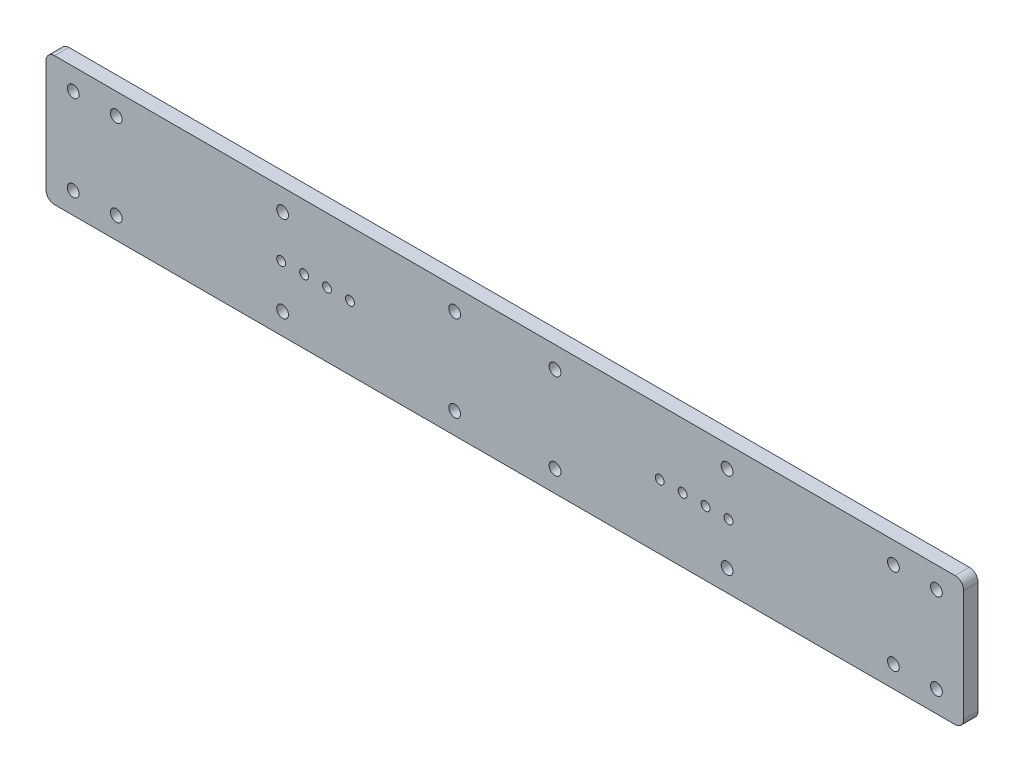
SolidWorks part; units mm, degrees
ref_plane "前视基准面" through (0, 0, 0) normal (0, 0, 1) x (1, 0, 0)
ref_plane "上视基准面" through (0, 0, 0) normal (0, 1, 0) x (1, 0, 0)
ref_plane "右视基准面" through (0, 0, 0) normal (1, 0, 0) x (0, 0, -1)
sketch "草图1" plane through (0, 0, 0) normal (0, 0, 1) x (1, 0, 0)
  line L0 (0, 0) -> (0, 22.5) construction
  line L1 (-160, -22.5) -> (160, -22.5)
  line L2 (-160, -22.5) -> (-160, 22.5)
  line L3 (-160, 22.5) -> (160, 22.5)
  line L4 (160, -22.5) -> (160, 22.5)
  line L5 (-160, -22.5) -> (160, 22.5) construction
  line L6 (-160, 22.5) -> (160, -22.5) construction
  line L7 (0, 0) -> (-160, 0) construction
  circle A0 centre (-17.5, 15) radius 2.05
  circle A1 centre (17.5, 15) radius 2.05
  circle A2 centre (17.5, -15) radius 2.05
  circle A3 centre (-17.5, -15) radius 2.05
  circle A4 centre (-150.5, 15) radius 2.05
  circle A5 centre (-135.5, 15) radius 2.05
  circle A6 centre (-135.5, -15) radius 2.05
  circle A7 centre (-150.5, -15) radius 2.05
  circle A8 centre (150.5, 15) radius 2.05
  circle A9 centre (150.5, -15) radius 2.05
  circle A10 centre (135.5, -15) radius 2.05
  circle A11 centre (135.5, 15) radius 2.05
  circle A12 centre (-77.5, 15) radius 2.05
  circle A13 centre (-77.5, -15) radius 2.05
  circle A14 centre (77.5, -15) radius 2.05
  circle A15 centre (77.5, 15) radius 2.05
  point P0 (0, 0)
  dimension "D3" = 4.1
  dimension "D4" = 35
  dimension "D5" = 30
  dimension "D6" = 2
  dimension "D8" = 30
  dimension "D9" = 9.5
  dimension "D10" = 2
  dimension "D12" = 4.1
  dimension "D1" = 320
  dimension "D2" = 45
  dimension "D7" = 2
  dimension "D11" = 2
  dimension "D13" = 2
extrude "凸台-拉伸1" add sketch "草图1" along normal blind 5
sketch "草图2" plane through (0, 0, 5) normal (0, 0, 1) x (1, 0, 0)
  line L0 (0, 0) -> (-165.3838, 0) construction
  line L1 (0, 0) -> (0, 53.0605) construction
  circle A0 centre (-70, 0) radius 1.55
  circle A1 centre (-78, 0) radius 1.55
  circle A2 centre (70, 0) radius 1.55
  circle A3 centre (78, 0) radius 1.55
  circle A4 centre (54, 0) radius 1.55
  circle A5 centre (62, 0) radius 1.55
  circle A6 centre (-54, 0) radius 1.55
  circle A7 centre (-62, 0) radius 1.55
  dimension "D1" = 3.1
  dimension "D2" = 3.1
  dimension "D3" = 70
  dimension "D4" = 8
  dimension "D5" = 2
extrude "切除-拉伸2" cut sketch "草图2" against normal blind 10
sketch "草图3" plane through (0, 0, 5) normal (0, 0, 1) x (1, 0, 0)
  line L0 (160, 22.5) -> (-160, 22.5) construction
  line L1 (-87, 22.5) -> (-47, 22.5)
  line L2 (-87, 22.5) -> (-87, -22.5)
  line L3 (-87, -22.5) -> (-47, -22.5)
  line L4 (-47, 22.5) -> (-47, -22.5)
  line L5 (-160, -22.5) -> (160, -22.5) construction
  line L6 (-160, 22.5) -> (-160, -22.5) construction
  circle A0 centre (-77.5, -15) radius 2.05 construction
  circle A1 centre (-70, 0) radius 1.55 construction
  circle A2 centre (-78, 0) radius 1.55 construction
  circle A3 centre (-77.5, 15) radius 2.05 construction
  circle A4 centre (-77.5, -15) radius 2.05
  circle A5 centre (-70, 0) radius 1.55
  circle A6 centre (-78, 0) radius 1.55
  circle A7 centre (-77.5, 15) radius 2.05
  circle A8 centre (-54, 0) radius 1.55 construction
  circle A9 centre (-62, 0) radius 1.55 construction
  circle A10 centre (-54, 0) radius 1.55
  circle A11 centre (-62, 0) radius 1.55
  dimension "D1" = 40
  dimension "D2" = 73
extrude "凸台-拉伸2" [suppressed] add sketch "草图3" along normal blind 5
sketch "草图4" plane through (0, -22.5, 0) normal (0, -1, 0) x (1, 0, 0)
  line L1 (-160, 0) -> (160, 0)
  line L2 (-160, 0) -> (-160, 5)
  line L3 (-160, 5) -> (160, 5)
  line L4 (160, 0) -> (160, 5)
extrude "切除-拉伸3" [suppressed] cut sketch "草图4" against normal blind 86
fillet "圆角1" radius 3 4 edges at (160, 22.5, 2.5) (160, -22.5, 2.5) (-160, 22.5, 2.5) (-160, -22.5, 2.5)
